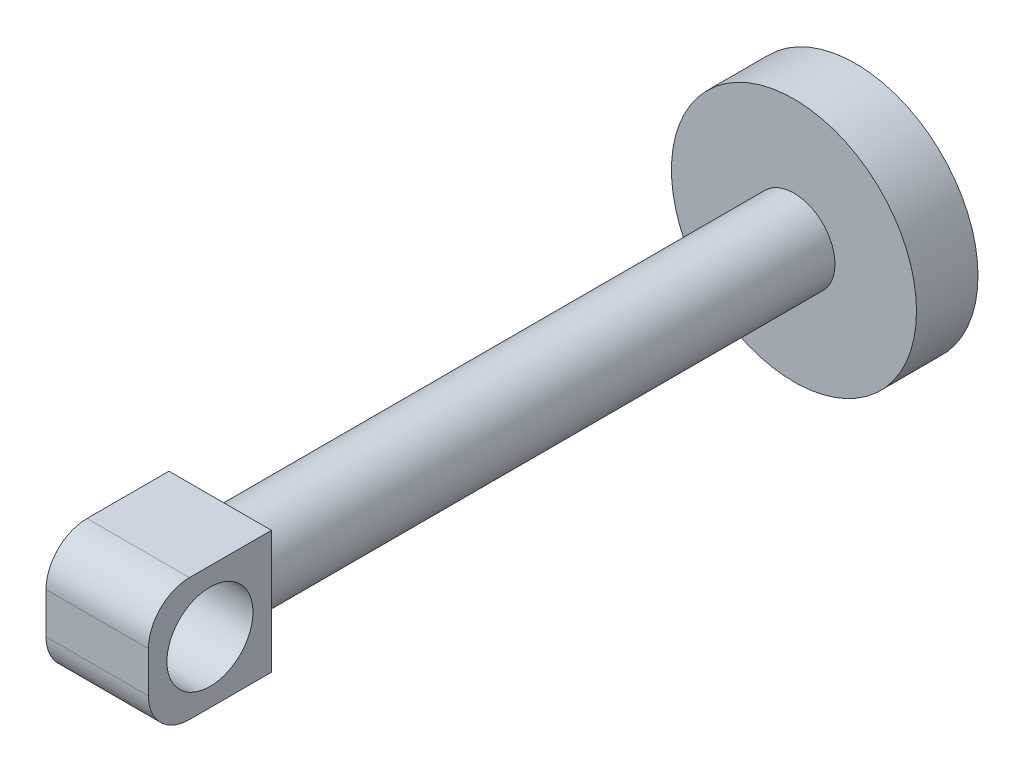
SolidWorks part; units mm, degrees
ref_plane "Front Plane" through (0, 0, 0) normal (0, 0, 1) x (1, 0, 0)
ref_plane "Top Plane" through (0, 0, 0) normal (0, 1, 0) x (1, 0, 0)
ref_plane "Right Plane" through (0, 0, 0) normal (1, 0, 0) x (0, 0, -1)
sketch "Sketch1" plane through (0, 0, 0) normal (0, 0, 1) x (1, 0, 0)
  circle A0 centre (0, 0) radius 37.973
  dimension "D1" = 75.946
extrude "Boss-Extrude1" add sketch "Sketch1" against normal blind 19.05
sketch "Sketch2" plane through (0, 0, 0) normal (0, 0, 1) x (1, 0, 0)
  circle A0 centre (0, 0) radius 12.7
  dimension "D1" = 25.4
extrude "Boss-Extrude2" add sketch "Sketch2" along normal blind 177.8
sketch "Sketch3" plane through (0, 0, 177.8) normal (0, 0, 1) x (1, 0, 0)
  line L1 (-15.875, -19.05) -> (15.875, -19.05)
  line L2 (-15.875, -19.05) -> (-15.875, 19.05)
  line L3 (-15.875, 19.05) -> (15.875, 19.05)
  line L4 (15.875, -19.05) -> (15.875, 19.05)
  line L5 (-15.875, -19.05) -> (15.875, 19.05) construction
  line L6 (-15.875, 19.05) -> (15.875, -19.05) construction
  point P0 (0, 0)
  dimension "D1" = 31.75
  dimension "D2" = 38.1
extrude "Boss-Extrude3" add sketch "Sketch3" along normal blind 38.1
fillet "Fillet1" radius 12.7 2 edges at (0, -19.05, 215.9) (0, 19.05, 215.9)
sketch "Sketch4" plane through (15.875, 0, 0) normal (1, 0, 0) x (0, 0, -1)
  line L0 (-215.9, 0) -> (-177.8, 0) construction
  line L1 (-215.9, -6.35) -> (-215.9, 6.35) construction
  line L2 (-177.8, -19.05) -> (-177.8, 19.05) construction
  circle A0 centre (-196.85, 0) radius 13.335
  dimension "D1" = 26.67
extrude "Cut-Extrude1" cut sketch "Sketch4" against normal blind 38.1
